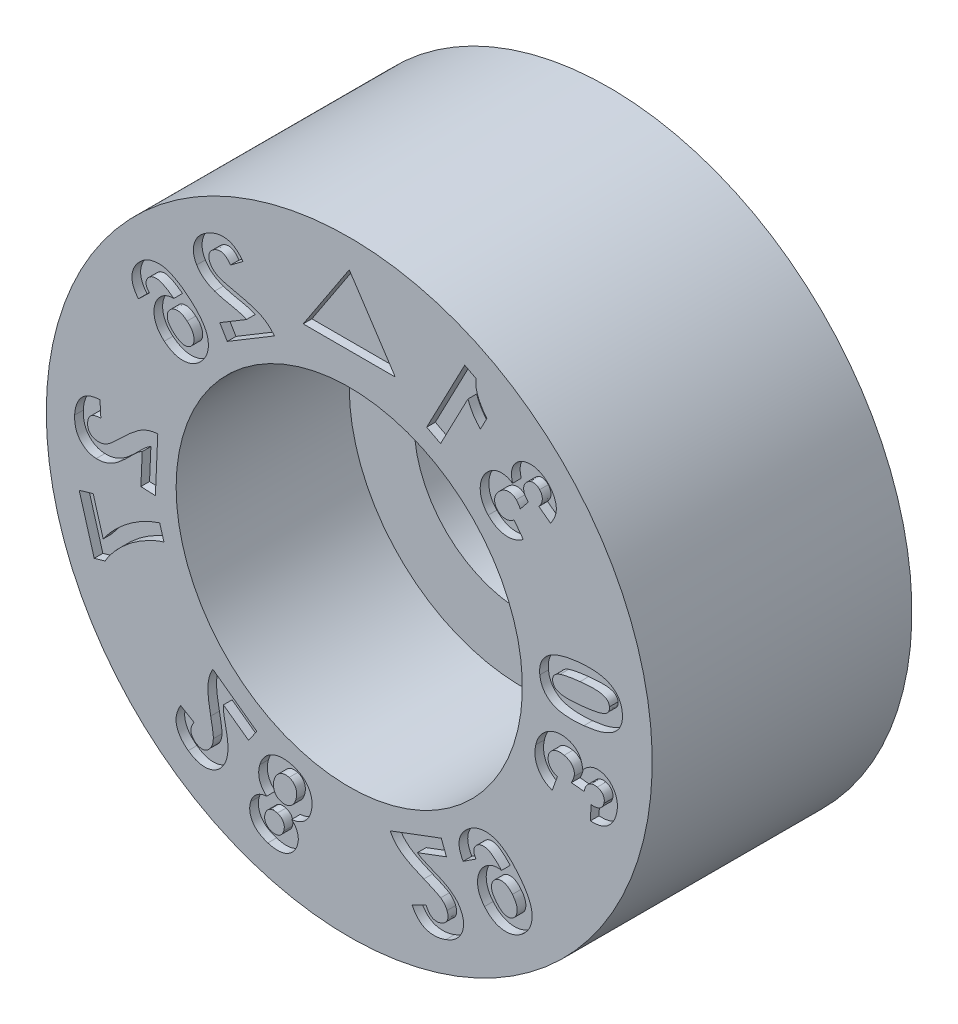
SolidWorks part; units mm, degrees
ref_plane "Front Plane" through (0, 0, 0) normal (0, 0, 1) x (1, 0, 0)
ref_plane "Top Plane" through (0, 0, 0) normal (0, 1, 0) x (1, 0, 0)
ref_plane "Right Plane" through (0, 0, 0) normal (1, 0, 0) x (0, 0, -1)
imported_body "Imported1"
other "Move Face1" parameters "D1"=0.22
other "DeleteFace2"
sketch "Sketch1" plane through (0, 0, 0) normal (0, 0, 1) x (1, 0, 0)
  arc A0 (-0.8358, 2.0974) -> (0.9668, 2.0403) centre (0, 0) ccw construction
  text T2 "26  27  28  29  30  31" font "Arial" height 0.95
extrude "Cut-Extrude1" cut sketch "Sketch1" against normal blind 0.1
other "Move Face2" parameters "D1"=1
other "Move Face3" parameters "D1"=2
sketch "Sketch2" plane through (0, 0, 0) normal (0, 1, 0) x (1, 0, 0)
  line L0 (3.5, 3) -> (-3.5, 3) construction
  line L1 (-2.2, 3) -> (-2.8, 3)
  arc A0 (-2.8, 3) -> (-2.2, 3) centre (-2.5, 3) cw
  dimension "D2" = 0.3
  dimension "D1" = 2.5
revolve "Revolve1" add sketch "Sketch2" angle 360 about L1
